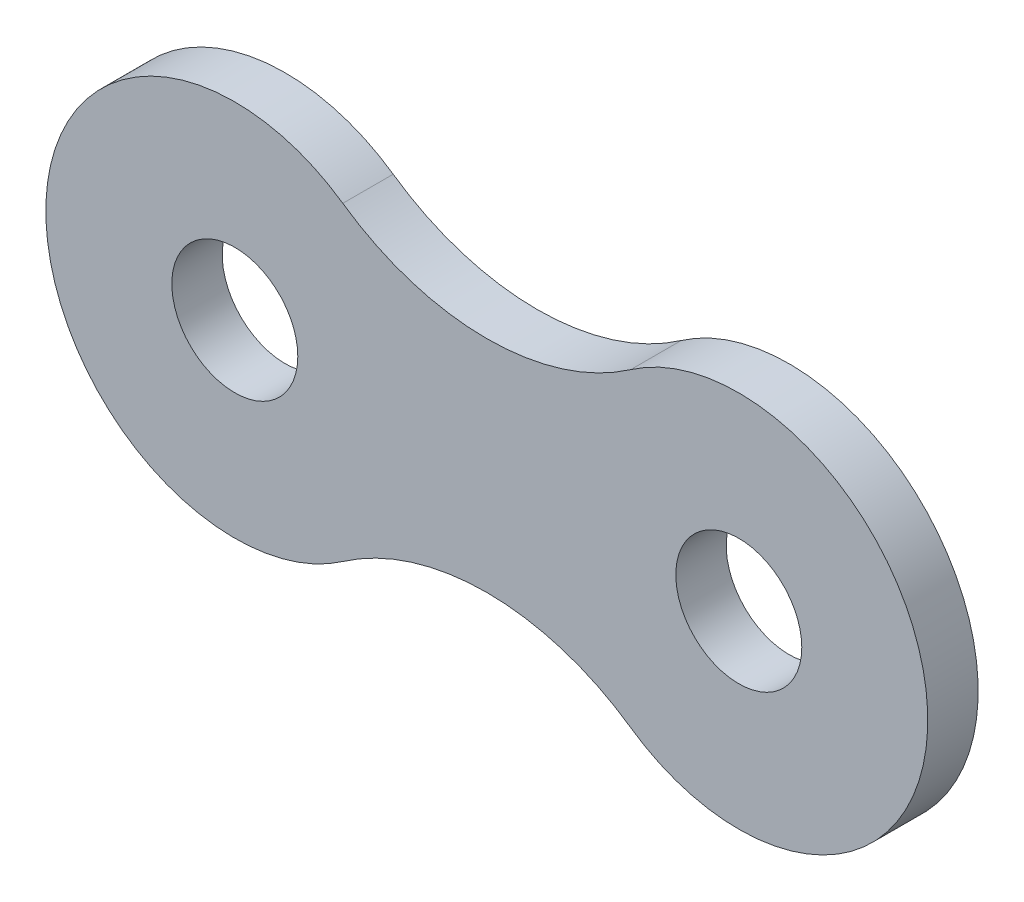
SolidWorks part; units mm, degrees
ref_plane "Ebene vorne" through (0, 0, 0) normal (0, 0, 1) x (1, 0, 0)
ref_plane "Ebene oben" through (0, 0, 0) normal (0, 1, 0) x (1, 0, 0)
ref_plane "Ebene rechts" through (0, 0, 0) normal (1, 0, 0) x (0, 0, -1)
sketch "Skizze1" plane through (0, 0, 0) normal (0, 0, 1) x (1, 0, 0)
  line L0 (0, 0) -> (20, 0) construction
  line L1 (10, 0) -> (10, 20.3503) construction
  circle A0 centre (0, 0) radius 2.5
  circle A1 centre (20, 0) radius 2.5
  arc A2 (4.2857, 6.1549) -> (4.2857, -6.1549) centre (0, 0) ccw
  arc A3 (15.7143, -6.1549) -> (15.7143, 6.1549) centre (20, 0) ccw
  arc A4 (15.7143, 6.1549) -> (4.2857, 6.1549) centre (10, 14.3614) cw
  arc A5 (15.7143, -6.1549) -> (4.2857, -6.1549) centre (10, -14.3614) ccw
  circle A6 centre (0, 0) radius 7.5 construction
  circle A7 centre (20, 0) radius 7.5 construction
  dimension "D2" = 5
  dimension "D3" = 20
  dimension "D4" = 10
  dimension "D1" = 5
extrude "Linear austragen1" add sketch "Skizze1" along normal blind 2
equation "\"LÄNGE\"=0"
equation "\"BREITE\"=0"
equation "\"HÖHE\"=0"
equation "\"DURCHMESSER\"=0"
equation "\"Stückzahl\"= 1"
